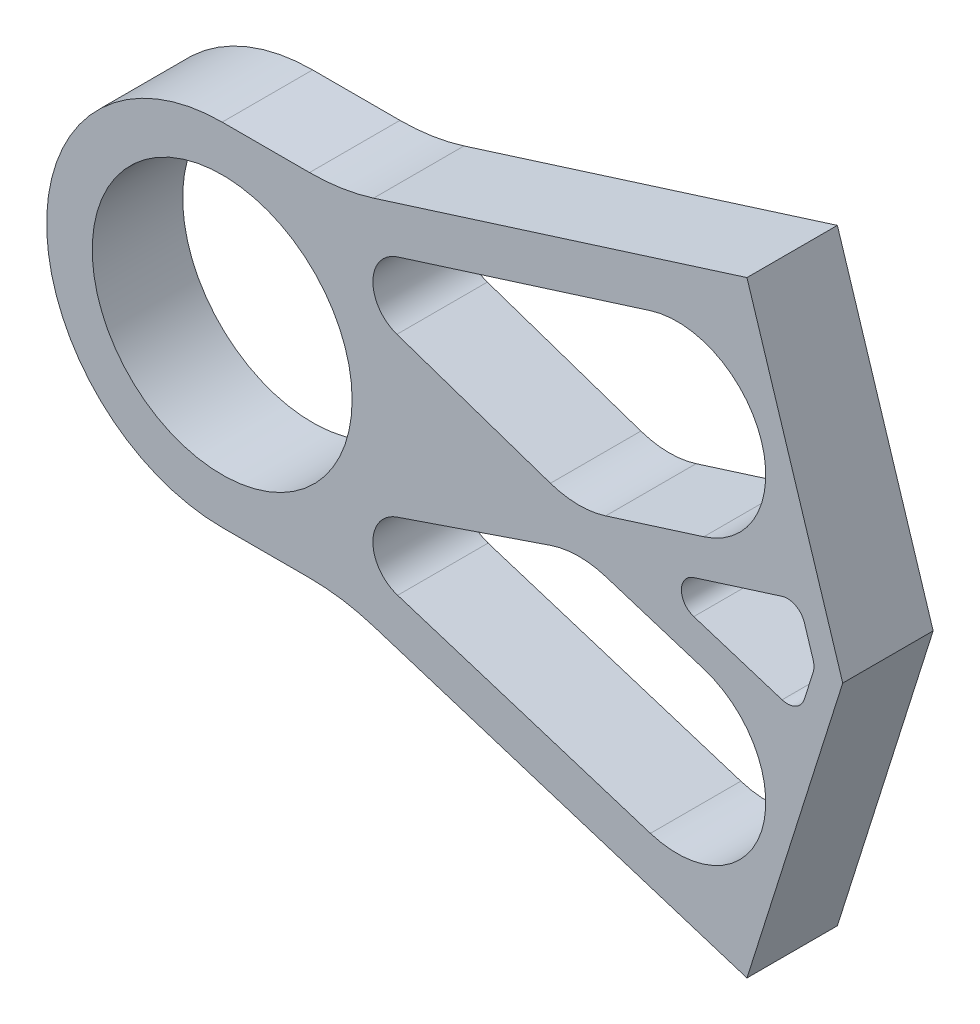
SolidWorks part; units mm, degrees
ref_plane "Front" through (0, 0, 0) normal (0, 0, 1) x (1, 0, 0)
ref_plane "Top" through (0, 0, 0) normal (0, 1, 0) x (1, 0, 0)
ref_plane "Right" through (0, 0, 0) normal (1, 0, 0) x (0, 0, -1)
sketch "Sketch1" plane through (0, 0, 0) normal (0, 0, 1) x (1, 0, 0)
  line L0 (0, 12.573) -> (6.2575, 12.573)
  line L1 (37.59, 21.725) -> (44.45, 0)
  line L2 (0, -12.573) -> (6.2575, -12.573)
  line L3 (0, 0) -> (57.15, 0) construction
  line L4 (10.8464, -13.2803) -> (37.59, -21.725)
  line L5 (10.8464, 13.2803) -> (37.59, 21.725)
  line L7 (44.45, 0) -> (37.59, -21.725)
  arc A0 (0, 12.573) -> (0, -12.573) centre (0, 0) ccw
  circle A1 centre (0, 0) radius 9.398
  arc A2 (10.8464, 13.2803) -> (6.2575, 12.573) centre (6.2575, 27.813) cw
  arc A3 (10.8464, -13.2803) -> (6.2575, -12.573) centre (6.2575, -27.813) ccw
  dimension "D2" = 18.796
  dimension "D4" = 18.796
  dimension "D6" = 15.24
  dimension "D3" = 44.45
  dimension "D7" = 35.049
  dimension "D1" = 3.175
extrude "Extrude1" add sketch "Sketch1" along normal mid plane 6.477
sketch "Sketch9" plane through (0, 0, 3.2385) normal (0, 0, -1) x (-1, 0, 0)
  line L0 (-23.6471, -13.9928) -> (-30.6742, -16.2117)
  line L1 (0, 0) -> (-97.544, 0) construction
  line L2 (-27.4712, -1.8822) -> (-34.4983, -4.1011)
  line L3 (-10.8464, -13.2803) -> (-37.59, -21.725) construction
  line L4 (-23.6471, 13.9928) -> (-12.5696, 10.4949)
  line L5 (-37.59, -21.725) -> (-44.45, 0) construction
  line L6 (-27.4712, 1.8822) -> (-34.4983, 4.1011)
  line L7 (-23.6471, 13.9928) -> (-30.6742, 16.2117)
  line L8 (-33.7812, -1.2111) -> (-40.1073, -3.2086)
  line L9 (-41.7008, -2.38) -> (-42.3315, -0.3824)
  line L10 (-42.3315, 0.3824) -> (-41.7008, 2.38)
  line L11 (-40.1073, 3.2086) -> (-33.7812, 1.2111)
  line L12 (-44.45, 0) -> (-37.59, 21.725) construction
  line L13 (-12.5162, 5.6682) -> (-23.5136, 1.926)
  line L14 (-12.5162, -5.6682) -> (-23.5136, -1.926)
  line L15 (-12.5696, -10.4949) -> (-23.6471, -13.9928)
  line L16 (-37.59, 21.725) -> (-10.8464, 13.2803) construction
  arc A0 (-23.5136, -1.926) -> (-27.4712, -1.8822) centre (-25.5592, -7.9375) ccw
  arc A1 (-34.4983, -4.1011) -> (-30.6742, -16.2117) centre (-32.5862, -10.1564) ccw
  arc A2 (-34.4983, 4.1011) -> (-30.6742, 16.2117) centre (-32.5862, 10.1564) cw
  arc A3 (-23.5136, 1.926) -> (-27.4712, 1.8822) centre (-25.5592, 7.9375) cw
  arc A4 (-33.7812, 1.2111) -> (-33.7812, -1.2111) centre (-34.1636, 0) cw
  arc A5 (-41.7008, -2.38) -> (-40.1073, -3.2086) centre (-40.4897, -1.9976) ccw
  arc A6 (-42.3315, -0.3824) -> (-42.3315, 0.3824) centre (-41.1205, 0) cw
  arc A7 (-40.1073, 3.2086) -> (-41.7008, 2.38) centre (-40.4897, 1.9976) ccw
  arc A8 (-12.5696, 10.4949) -> (-12.5162, 5.6682) centre (-13.3344, 8.0728) cw
  arc A9 (-12.5162, -5.6682) -> (-12.5696, -10.4949) centre (-13.3344, -8.0728) cw
  arc A10 (0, 9.398) -> (0, -9.398) centre (0, 0) ccw construction
  point P27 (-29.9459, 0)
  point P32 (-42.4523, 0)
  dimension "D2" = 12.7
  dimension "D3" = 1.905
  dimension "D5" = 2.54
  dimension "D4" = 3.175
  dimension "D7" = 1.27
  dimension "D8" = 2.54
  dimension "D1" = 3.175
  dimension "D6" = 1.905
extrude "Cut-Extrude3" cut sketch "Sketch9" along normal through all
sketch "Sketch10" plane through (0, 0, 3.2385) normal (0, 0, 1) x (1, 0, 0)
  arc A0 (0, 9.398) -> (0, -9.398) centre (0, 0) ccw construction
  arc A4 (0, 9.398) -> (0, -9.398) centre (0, 0) ccw
  arc A5 (0, -9.398) -> (0, 9.398) centre (0, 0) ccw
  arc A6 (0, -9.3091) -> (0, 9.3091) centre (0, 0) ccw
  arc A7 (0, 9.3091) -> (0, -9.3091) centre (0, 0) ccw
  dimension "D1" = 9.3091
extrude "Extrude2" add sketch "Sketch10" against normal up to surface (6.477 mm away)
